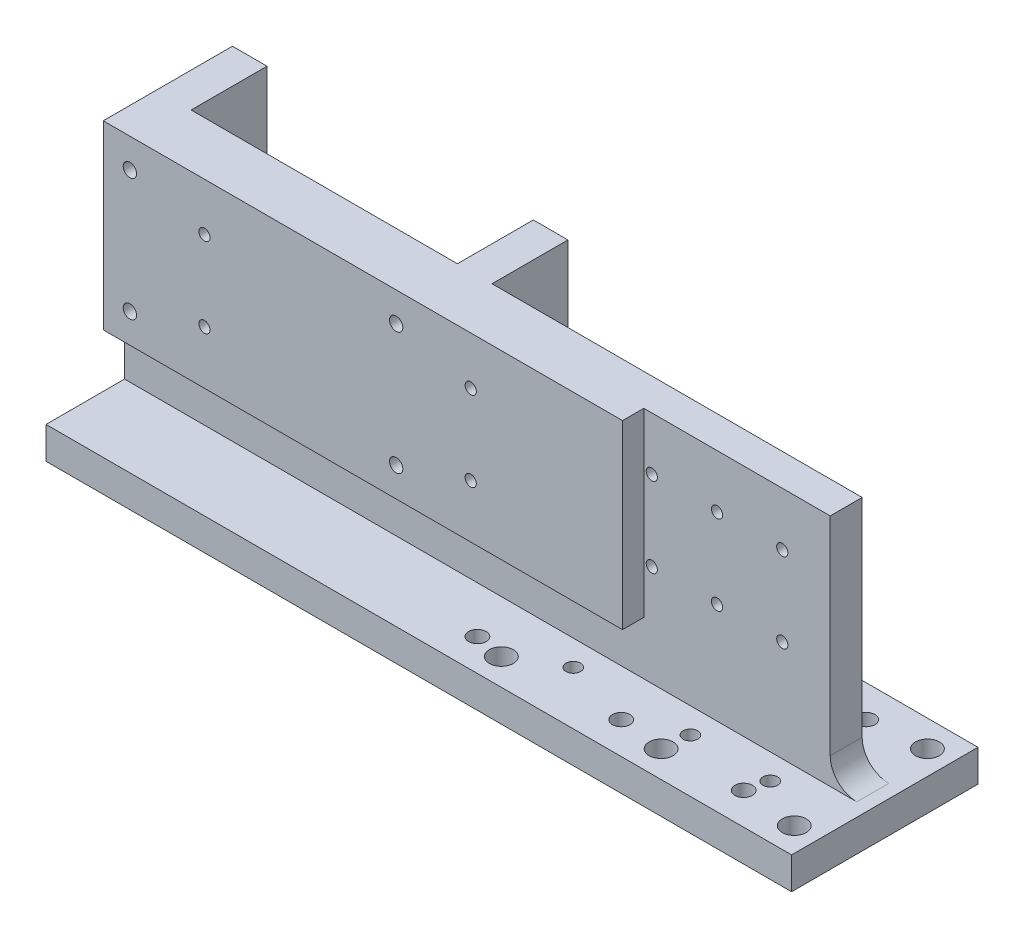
SolidWorks part; units mm, degrees
ref_plane "Front Plane" through (0, 0, 0) normal (0, 0, 1) x (1, 0, 0)
ref_plane "Top Plane" through (0, 0, 0) normal (0, 1, 0) x (1, 0, 0)
ref_plane "Right Plane" through (0, 0, 0) normal (1, 0, 0) x (0, 0, -1)
sketch "Sketch1" plane through (0, 0, 0) normal (0, 1, 0) x (1, 0, 0)
  line L1 (140, -35) -> (-140, -35)
  line L2 (140, -35) -> (140, 35)
  line L3 (140, 35) -> (-140, 35)
  line L4 (-140, -35) -> (-140, 35)
  line L5 (140, -35) -> (-140, 35) construction
  line L6 (140, 35) -> (-140, -35) construction
  point P0 (0, 0)
  dimension "D1" = 280
  dimension "D2" = 70
extrude "Boss-Extrude1" add sketch "Sketch1" along normal blind 12
sketch "Sketch2" plane through (0, 12, 0) normal (0, 1, 0) x (1, 0, 0)
  line L0 (-140, 35) -> (-140, -13.5)
  line L1 (-140, 35) -> (-140, -35) construction
  line L2 (-140, -13.5) -> (125, -13.5)
  line L3 (125, -13.5) -> (125, 6.5)
  line L4 (125, 6.5) -> (-14, 6.5)
  line L5 (-14, 6.5) -> (-14, 35)
  line L6 (140, 35) -> (-140, 35) construction
  line L7 (-14, 35) -> (-27, 35)
  line L8 (-27, 35) -> (-27, 6.5)
  line L9 (-27, 6.5) -> (-127, 6.5)
  line L10 (-127, 6.5) -> (-127, 35)
  line L11 (-127, 35) -> (-140, 35)
  line L12 (140, -35) -> (140, 35) construction
  dimension "D1" = 15
  dimension "D2" = 20
  dimension "D3" = 13
  dimension "D4" = 13
  dimension "D5" = 48.5
  dimension "D6" = 113
extrude "Boss-Extrude2" add sketch "Sketch2" along normal blind 88
fillet "Fillet2" radius 12.7 3 edges at (-127, 12, -20.75) (-27, 12, -20.75) (-14, 12, -20.75)
sketch "Sketch3" plane through (0, 0, 13.5) normal (0, 0, 1) x (1, 0, 0)
  line L0 (-140, 12) -> (125, 12) construction
  line L1 (125, 100) -> (55, 100)
  line L2 (125, 100) -> (125, 12)
  line L3 (125, 12) -> (55, 12)
  line L4 (55, 100) -> (55, 12)
  line L5 (140, 12) -> (140, 0) construction
  dimension "D1" = 85
extrude "Cut-Extrude1" cut sketch "Sketch3" against normal blind 8
sketch "Sketch4" plane through (0, 0, 13.5) normal (0, 0, 1) x (1, 0, 0)
  line L0 (55, 100) -> (55, 12) construction
  line L1 (-140, 12) -> (55, 12)
  line L2 (-140, 12) -> (-140, 32)
  line L3 (-140, 32) -> (55, 32)
  line L4 (55, 12) -> (55, 32)
  dimension "D1" = 20
extrude "Cut-Extrude2" cut sketch "Sketch4" against normal up to surface (8 mm away)
fillet "Fillet1" radius 10 1 edges at (125, 12, -0.5)
hole_wizard "M8 Clearance Hole1" positions "Sketch5" profile "Sketch6" hole size "M8" standard "ANSI Metric"
sketch "Sketch5" plane through (0, 12, 0) normal (0, 1, 0) x (1, 0, 0)
  line L0 (131, -25) -> (21, -25) construction
  line L1 (21, -25) -> (21, 25) construction
  line L2 (21, 25) -> (131, 25) construction
  line L4 (131, 25) -> (131, -25) construction
  line L6 (140, -35) -> (140, 35) construction
  line L7 (81, -25) -> (81, 25) construction
  point P0 (131, 25)
  point P2 (81, 25)
  point P4 (21, 25)
  point P6 (21, -25)
  point P8 (81, -25)
  point P10 (131, -25)
  point P26 (131, 0)
  point P29 (140, 0)
  dimension "D1" = 50
  dimension "D2" = 9
  dimension "D3" = 50
  dimension "D4" = 110
sketch "Sketch6" plane through (131, 12, -25) normal (1, 0, 0) x (0, 0, 1)
  line L0 (0, 0) -> (0, 12)
  line L1 (0, 12) -> (4.5, 12)
  line L2 (4.5, 12) -> (4.5, 0)
  line L5 (4.5, 0) -> (0, 0)
  line L11 (0, -6.35) -> (0, 107.95) construction
  dimension "Thru Hole Dia." = 9
  dimension "Thru Hole Depth" = 12
hole_wizard "M6 Clearance Hole1" positions "Sketch7" profile "Sketch8" hole size "M6" standard "ANSI Metric"
sketch "Sketch7" plane through (0, 12, 0) normal (0, 1, 0) x (1, 0, 0)
  line L0 (10, 23) -> (110, 23) construction
  line L1 (110, 23) -> (110, -23) construction
  line L2 (110, -23) -> (10, -23) construction
  line L3 (10, -23) -> (10, 23) construction
  line L5 (64, 23) -> (64, -23) construction
  line L7 (140, -35) -> (140, 35) construction
  point P0 (110, 23)
  point P2 (110, -23)
  point P4 (64, 23)
  point P6 (64, -23)
  point P8 (10, 23)
  point P10 (10, -23)
  point P27 (110, 0)
  point P30 (140, 0)
  dimension "D1" = 46
  dimension "D2" = 46
  dimension "D3" = 100
  dimension "D4" = 30
sketch "Sketch8" plane through (110, 12, -23) normal (1, 0, 0) x (0, 0, 1)
  line L0 (0, 0) -> (0, 12)
  line L1 (0, 12) -> (3.3, 12)
  line L2 (3.3, 12) -> (3.3, 0)
  line L5 (3.3, 0) -> (0, 0)
  line L11 (0, -6.35) -> (0, 107.95) construction
  dimension "Thru Hole Dia." = 6.6
  dimension "Thru Hole Depth" = 12
hole_wizard "M5 Clearance Hole1" positions "Sketch9" profile "Sketch10" hole size "M5" standard "ANSI Metric"
sketch "Sketch9" plane through (0, 12, 0) normal (0, 1, 0) x (1, 0, 0)
  line L0 (38, -15) -> (38, 15) construction
  line L1 (38, 15) -> (112, 15) construction
  line L2 (112, 15) -> (112, -15) construction
  line L3 (112, -15) -> (38, -15) construction
  line L5 (140, -35) -> (140, 35) construction
  line L6 (82, 15) -> (82, -15) construction
  point P0 (112, 15)
  point P2 (112, -15)
  point P4 (82, 15)
  point P6 (82, -15)
  point P8 (38, 15)
  point P10 (38, -15)
  point P23 (112, 0)
  point P26 (140, 0)
  dimension "D1" = 30
  dimension "D2" = 74
  dimension "D3" = 28
  dimension "D4" = 30
sketch "Sketch10" plane through (112, 12, -15) normal (1, 0, 0) x (0, 0, 1)
  line L0 (0, 0) -> (0, 12)
  line L1 (0, 12) -> (2.75, 12)
  line L2 (2.75, 12) -> (2.75, 0)
  line L5 (2.75, 0) -> (0, 0)
  line L11 (0, -6.35) -> (0, 107.95) construction
  dimension "Thru Hole Dia." = 5.5
  dimension "Thru Hole Depth" = 12
hole_wizard "M6x1.0 Tapped Hole1" positions "Sketch11" profile "Sketch12" tap size "M6x1.0" standard "ANSI Metric"
sketch "Sketch11" plane through (0, 0, 13.5) normal (0, 0, 1) x (1, 0, 0)
  line L0 (-30, 43) -> (-30, 89) construction
  line L1 (-30, 89) -> (-130, 89) construction
  line L2 (-130, 89) -> (-130, 43) construction
  line L3 (-130, 43) -> (-30, 43) construction
  line L6 (-140, 0) -> (140, 0) construction
  line L7 (140, 12) -> (140, 0) construction
  point P0 (-130, 89)
  point P2 (-130, 43)
  point P4 (-30, 89)
  point P6 (-30, 43)
  dimension "D1" = 46
  dimension "D2" = 170
  dimension "D3" = 100
  dimension "D4" = 43
sketch "Sketch12" plane through (-130, 89, 13.5) normal (1, 0, 0) x (0, -1, 0)
  line L0 (0, 0) -> (0, 18.5022)
  line L1 (0, 18.5022) -> (2.5, 17)
  line L2 (2.5, 17) -> (2.5, 0)
  line L5 (2.5, 0) -> (0, 0)
  line L10 (0, 18.5022) -> (-2.5, 17) construction
  line L11 (0, -6.35) -> (0, 107.95) construction
  dimension "Tap Drill Dia." = 5
  dimension "Tap Drill Depth" = 17
  dimension "Drill Angle" = 118
hole_wizard "M5x0.8 Tapped Hole1" positions "Sketch13" profile "Sketch14" tap size "M5x0.8" standard "ANSI Metric"
sketch "Sketch13" plane through (0, 0, 5.5) normal (0, 0, 1) x (1, 0, 0)
  line L0 (107, 80) -> (107, 50) construction
  line L1 (107, 50) -> (58, 50) construction
  line L2 (58, 50) -> (58, 80) construction
  line L3 (58, 80) -> (107, 80) construction
  line L5 (82.5, 80) -> (82.5, 50) construction
  line L8 (-140, 0) -> (140, 0) construction
  line L9 (140, 12) -> (140, 0) construction
  point P0 (107, 80)
  point P2 (82.5, 80)
  point P4 (58, 80)
  point P6 (58, 50)
  point P8 (82.5, 50)
  point P10 (107, 50)
  dimension "D1" = 24.5
  dimension "D2" = 24.5
  dimension "D3" = 33
  dimension "D4" = 50
  dimension "D5" = 30
sketch "Sketch14" plane through (107, 80, 5.5) normal (1, 0, 0) x (0, -1, 0)
  line L0 (0, 0) -> (0, 40.5)
  line L1 (0, 40.5) -> (2.1, 40.5)
  line L2 (2.1, 40.5) -> (2.1, 0)
  line L5 (2.1, 0) -> (0, 0)
  line L11 (0, -6.35) -> (0, 107.95) construction
  dimension "Thru Tap Drill Dia." = 4.2
  dimension "Thru Tap Drill Depth" = 40.5
hole_wizard "M5x0.8 Tapped Hole2" positions "Sketch15" profile "Sketch16" tap size "M5x0.8" standard "ANSI Metric"
sketch "Sketch15" plane through (0, 0, 13.5) normal (0, 0, 1) x (1, 0, 0)
  line L0 (-102, 52) -> (-102, 82) construction
  line L1 (-102, 82) -> (-2, 82) construction
  line L2 (-2, 82) -> (-2, 52) construction
  line L3 (-2, 52) -> (-102, 52) construction
  line L6 (-140, 0) -> (140, 0) construction
  line L7 (140, 12) -> (140, 0) construction
  point P0 (-102, 82)
  point P2 (-102, 52)
  point P4 (-2, 82)
  point P6 (-2, 52)
  dimension "D1" = 100
  dimension "D2" = 30
  dimension "D3" = 142
  dimension "D4" = 52
sketch "Sketch16" plane through (-102, 82, 13.5) normal (1, 0, 0) x (0, -1, 0)
  line L0 (0, 0) -> (0, 15.2618)
  line L1 (0, 15.2618) -> (2.1, 14)
  line L2 (2.1, 14) -> (2.1, 0)
  line L5 (2.1, 0) -> (0, 0)
  line L10 (0, 15.2618) -> (-2.1, 14) construction
  line L11 (0, -6.35) -> (0, 107.95) construction
  dimension "Tap Drill Dia." = 4.2
  dimension "Tap Drill Depth" = 14
  dimension "Drill Angle" = 118
